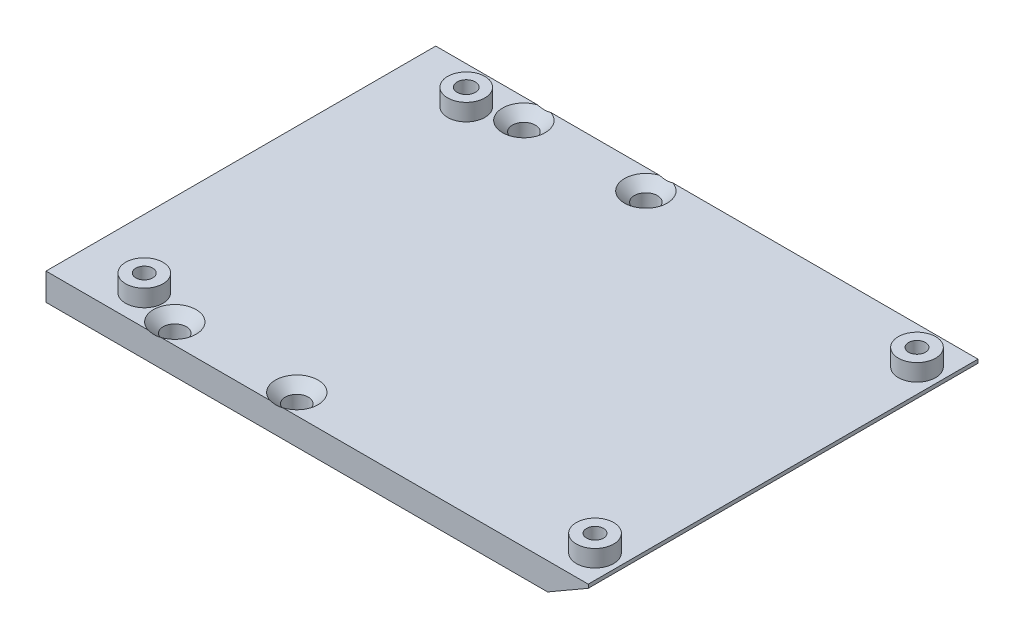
SolidWorks part; units mm, degrees
ref_plane "Front" through (0, 0, 0) normal (0, 0, 1) x (1, 0, 0)
ref_plane "Top" through (0, 0, 0) normal (0, 1, 0) x (1, 0, 0)
ref_plane "Right" through (0, 0, 0) normal (1, 0, 0) x (0, 0, -1)
sketch "Эскиз1" plane through (0, 0, 0) normal (0, 1, 0) x (1, 0, 0)
  line L1 (0, 0) -> (80, 0)
  line L2 (0, 0) -> (0, -54.5)
  line L3 (0, -54.5) -> (80, -54.5)
  line L4 (80, 0) -> (80, -54.5)
  dimension "D1" = 54.5
  dimension "D2" = 80
extrude "Бобышка-Вытянуть1" add sketch "Эскиз1" along normal blind 4
hole_wizard "Отверстие обработанное метчиком M3x0.51" positions "Эскиз5" profile "Эскиз4" tap size "M3x0.5" standard "Ansi Metric"
sketch "Эскиз5" plane through (0, 4, 0) normal (0, 1, 0) x (1, 0, 0)
  line L0 (0, 0) -> (0, -54.5) construction
  line L1 (3.5, -3.5) -> (13.6691, -3.5) construction
  line L3 (3.5, -51) -> (15.4189, -51) construction
  point P0 (10, -3.5)
  point P2 (76.5, -3.5)
  point P4 (76.5, -51)
  point P6 (10, -51)
  dimension "D1" = 10
  dimension "D2" = 66.5
sketch "Эскиз4" plane through (10, 4, 3.5) normal (1, 0, 0) x (0, 0, 1)
  line L0 (0, 0) -> (0, 4)
  line L1 (0, 4) -> (1.25, 4)
  line L2 (1.25, 4) -> (1.25, 0)
  line L5 (1.25, 0) -> (0, 0)
  line L11 (0, -6.35) -> (0, 107.95) construction
  dimension "Диаметр проходного сверла" = 2.5
  dimension "Глубина проходного сверла" = 4
sketch "Эскиз8" plane through (0, 4, 0) normal (0, 1, 0) x (1, 0, 0)
  circle A0 centre (76.5, -51) radius 2.75
  circle A1 centre (76.5, -3.5) radius 2.75
  circle A2 centre (10, -51) radius 2.75
  circle A3 centre (10, -3.5) radius 2.75
  circle A4 centre (10, -3.5) radius 1.3421
  circle A5 centre (10, -51) radius 1.25
  circle A6 centre (76.5, -3.5) radius 1.25
  circle A7 centre (76.5, -51) radius 1.25
  dimension "D1" = 5.5
  dimension "D2" = 5.5
  dimension "D3" = 5.5
  dimension "D4" = 5.5
extrude "Бобышка-Вытянуть2" add sketch "Эскиз8" along normal blind 2.5
chamfer "Фаска3" distance 4 angle 30 1 edges at (80, 0, 27.25)
sketch "Эскиз9" plane through (19, -32.909, 0) normal (0.5, -0.866, 0) x (-0.866, -0.5, 0)
  circle A0 centre (-68.0672, -27.02) radius 36.2937
extrude "Вырез-Вытянуть3" cut sketch "Эскиз9" against normal blind 1
sketch "Эскиз10" plane through (0, 0, 0) normal (0, 0, -1) x (-1, 0, 0)
  line L0 (-80, 3.4641) -> (-80, 4)
  line L1 (-80, 4) -> (0, 4)
  line L2 (0, 4) -> (0, 0)
  line L3 (0, 0) -> (-74, 0)
  line L4 (-74, 0) -> (-80, 3.4641)
extrude "Бобышка-Вытянуть3" add sketch "Эскиз10" along normal blind 2
sketch "Эскиз11" plane through (0, 0, 54.5) normal (0, 0, 1) x (1, 0, 0)
  line L0 (80, 4) -> (80, 3.4641)
  line L1 (80, 3.4641) -> (74, 0)
  line L2 (74, 0) -> (0, 0)
  line L3 (0, 0) -> (0, 4)
  line L4 (0, 4) -> (80, 4)
extrude "Бобышка-Вытянуть4" add sketch "Эскиз11" along normal blind 1
sketch "Эскиз13" plane through (0, 4, 0) normal (0, 1, 0) x (1, 0, 0)
  line L0 (0, 2) -> (0, -1) construction
  line L1 (0, 2) -> (0, -55.5) construction
  line L2 (0, -1) -> (16, -1) construction
  line L3 (16, -1) -> (34, -1) construction
  line L4 (0, -26.75) -> (4.8338, -26.75) construction
  circle A0 centre (34, -1) radius 1
  circle A1 centre (16, -1) radius 1
  circle A2 centre (16, -52.5) radius 1
  circle A3 centre (34, -52.5) radius 1
  dimension "D4" = 2
  dimension "D5" = 2
  dimension "D1" = 3
  dimension "D2" = 16
  dimension "D3" = 18
extrude "Вырез-Вытянуть5" cut sketch "Эскиз13" against normal blind 5
hole_wizard "Зенковка для винта с полупотайной головкой M31" positions "Эскиз14" profile "Эскиз15" countersink size "M3" standard "ISO"
sketch "Эскиз14" plane through (0, 4, 0) normal (0, 1, 0) x (1, 0, 0)
  point P0 (16, -1)
  point P3 (34, -1)
  point P6 (34, -52.5)
  point P9 (16, -52.5)
sketch "Эскиз15" plane through (16, 4, 1) normal (1, 0, 0) x (0, 0, 1)
  line L0 (0, 0) -> (0, 8.5215)
  line L1 (0, 8.5215) -> (1.7, 7.5)
  line L2 (1.7, 7.5) -> (1.7, 1.45)
  line L3 (1.7, 1.45) -> (3.15, 0)
  line L5 (3.15, 0) -> (0, 0)
  line L6 (-1.7, 1.45) -> (-3.15, 0) construction
  line L10 (0, 8.5215) -> (-1.7, 7.5) construction
  line L11 (0, -6.35) -> (0, 107.95) construction
  dimension "Диаметр отверстия" = 3.4
  dimension "Глубина отверстия" = 7.5
  dimension "Диаметр передней зенковки" = 6.3
  dimension "Угол передней зенковки" = 90
  dimension "Угол заточки сверла" = 118
